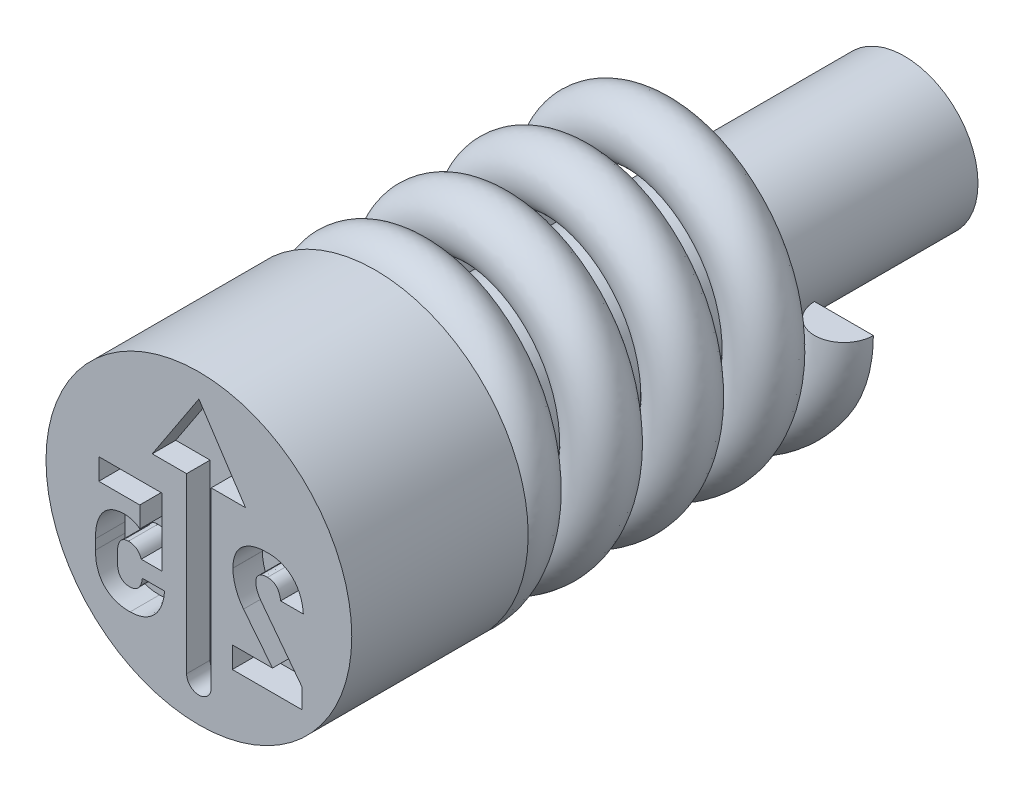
SolidWorks part; units mm, degrees
other "<DCSPR10>-<Cut-Extrude1>"
ref_plane "Front Plane" through (0, 0, 0) normal (0, 0, 1) x (1, 0, 0)
ref_plane "Top Plane" through (0, 0, 0) normal (0, 1, 0) x (1, 0, 0)
ref_plane "Right Plane" through (0, 0, 0) normal (1, 0, 0) x (0, 0, -1)
sketch "Sketch2" plane through (0, 0, 0) normal (0, 1, 0) x (1, 0, 0)
  line L5 (2.6, 0) -> (2.6, 3)
  line L6 (2.6, 3) -> (1.25, 3)
  line L7 (1.25, 3) -> (1.25, 12)
  line L8 (1.25, 12) -> (0, 12)
  line L9 (0, 0) -> (2.6, 0)
  line L10 (0, 0) -> (0, 50000) construction
  line L11 (0, 12) -> (0, 0)
  dimension "D1" = 3
  dimension "D2" = 12
  dimension "D3" = 5.2
  dimension "D4" = 2.5
revolve "Revolve1" add sketch "Sketch2" angle 360 about L10
sketch "Sketch3" plane through (0, 0, 0) normal (0, 0, 1) x (1, 0, 0)
  line L0 (-0.2093, 0.9958) -> (-0.7931, 0.9958)
  line L1 (0, -0.9219) -> (0, 0.9385) construction
  line L2 (-0.2093, -1.9514) -> (-0.2093, 0.9958)
  line L3 (-0.7931, 0.9958) -> (0, 2.1996)
  line L12 (0.7931, 0.9958) -> (0, 2.1996)
  line L16 (0.2093, -1.9514) -> (0.2093, 0.9958)
  line L17 (0.2093, 0.9958) -> (0.7931, 0.9958)
  arc A2 (-0.2093, -1.9514) -> (0.2093, -1.9514) centre (0, -1.9514) ccw
extrude "Cut-Extrude1" cut sketch "Sketch3" against normal blind 0.4
sketch "Sketch4" plane through (0, 0, 0) normal (0, 0, 1) x (1, 0, 0)
  text T0 "2  5" font "Bahnschrift" height 2
  dimension "D1" = 1.5
  dimension "D2" = 1.9
extrude "Cut-Extrude2" cut sketch "Sketch4" against normal blind 0.5
inserted part "DCSPR10"
move or copy body "Body-Move/Copy2" placed by mates yes
